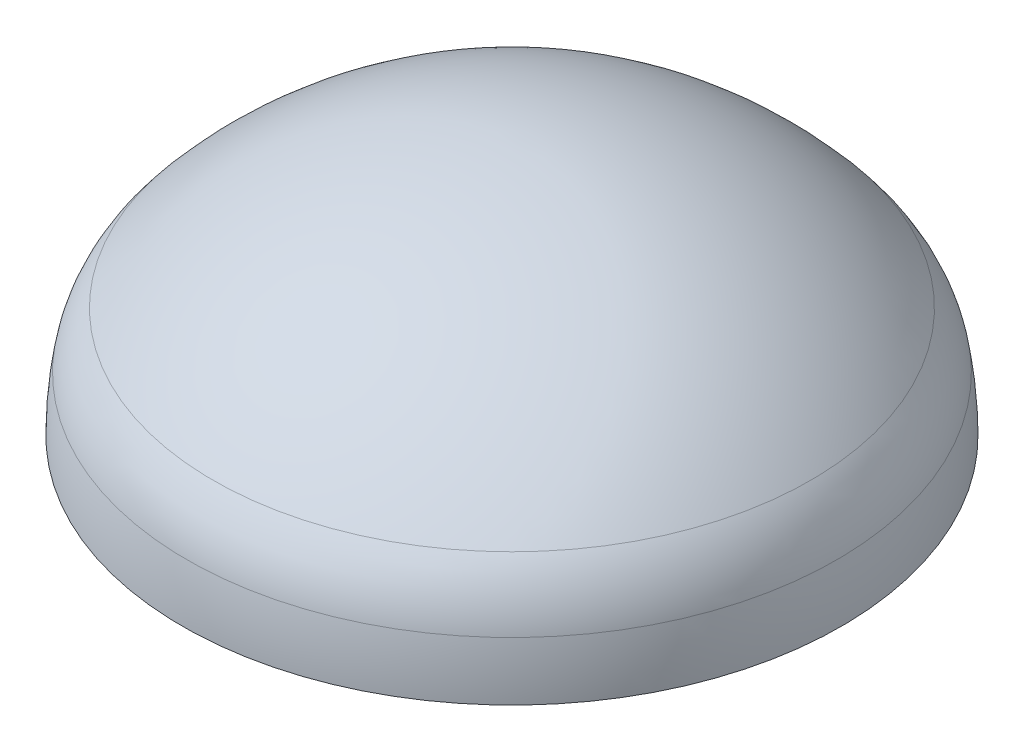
SolidWorks part; units mm, degrees
ref_plane "Plan de face" through (0, 0, 0) normal (0, 0, 1) x (1, 0, 0)
ref_plane "Plan de dessus" through (0, 0, 0) normal (0, 1, 0) x (1, 0, 0)
ref_plane "Plan de droite" through (0, 0, 0) normal (1, 0, 0) x (0, 0, -1)
sketch "Esquisse1" plane through (0, 0, 0) normal (0, 0, 1) x (1, 0, 0)
  line L0 (0, 0) -> (0, 21.5) construction
  line L1 (0, 0) -> (-28.5, 0) construction
  line L2 (-28.5, 21.5) -> (0, 21.5) construction
  line L3 (-28.5, 21.5) -> (-28.5, 0) construction
  arc A0 (0, 21.5) -> (-25.8378, 9.6) centre (0, -12.5) ccw
  arc A1 (-28.5, 0) -> (-28.097, 4.7757) centre (0, 0) cw
  arc A2 (-25.8378, 9.6) -> (-28.097, 4.7757) centre (-18.2384, 3.1) ccw
  point P4 (0, -12.5)
  dimension "D2" = 28.5
  dimension "D3" = 34
  dimension "D4" = 10
  dimension "D1" = 12.5
  dimension "D5" = 21.5
  dimension "D6" = 28.5
revolve "Révol.-Mince1" add sketch "Esquisse1" angle 360 about L0
